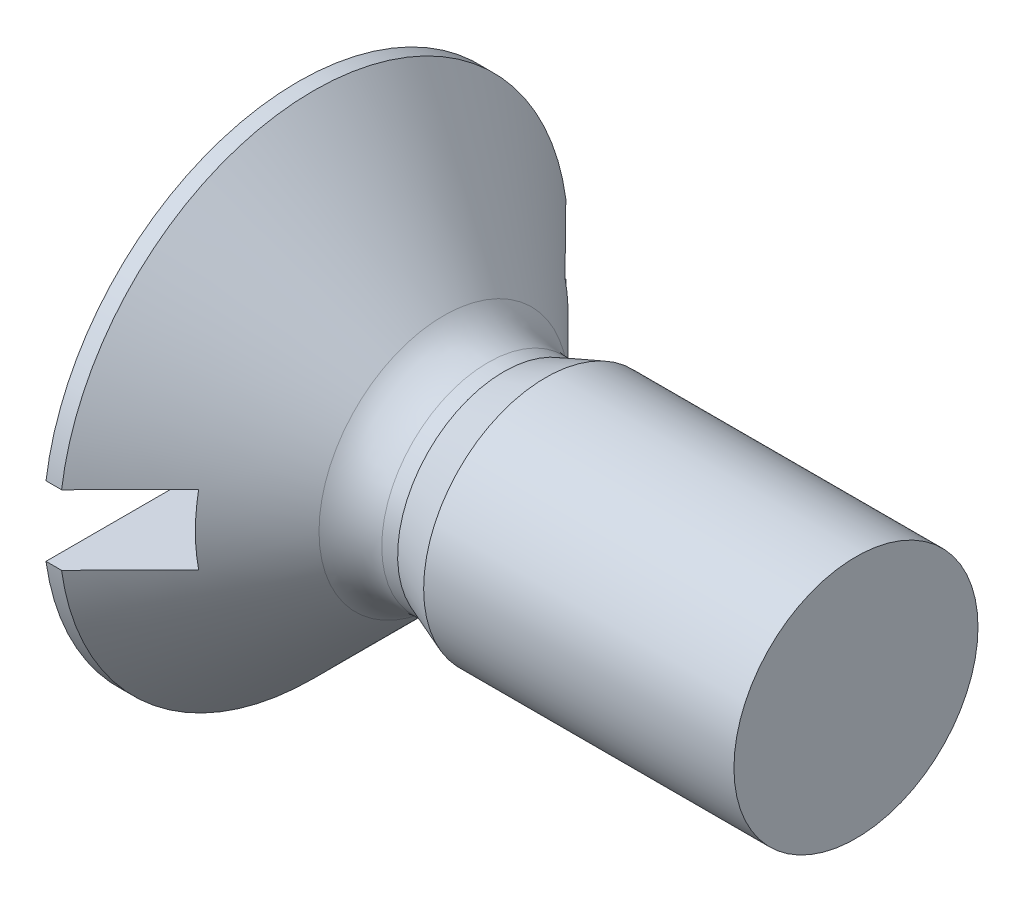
SolidWorks part; units mm, degrees
ref_plane "Plan de face" through (0, 0, 0) normal (0, 0, 1) x (1, 0, 0)
ref_plane "Plan de dessus" through (0, 0, 0) normal (0, 1, 0) x (1, 0, 0)
ref_plane "Plan de droite" through (0, 0, 0) normal (1, 0, 0) x (0, 0, -1)
imported_body "Importée3"
sketch "Esquisse1" plane through (0.2232, 0, 0) normal (-1, 0, 0) x (0, 0, 1)
  line L0 (3.6156, 0.5) -> (-3.6156, 0.5)
  arc A0 (-3.6156, 0.5) -> (3.6156, 0.5) centre (0, 0) cw
extrude "Boss.-Extru.1" add sketch "Esquisse1" along normal blind 0.2232
sketch "Esquisse2" plane through (0.2232, 0, 0) normal (-1, 0, 0) x (0, 0, 1)
  line L0 (-3.6156, -0.5) -> (3.6156, -0.5)
  arc A0 (3.6156, -0.5) -> (-3.6156, -0.5) centre (0, 0) cw
extrude "Boss.-Extru.2" add sketch "Esquisse2" along normal blind 0.2232
sketch "Esquisse3" plane through (3.55, 0, 0) normal (1, 0, 0) x (0, 0, -1)
  circle A0 centre (0, 0) radius 1.75
extrude "Boss.-Extru.3" add sketch "Esquisse3" along normal blind 4.45
fillet "Congé1" radius 0.9 1 edges at (2.35, 0, 1.5232)
